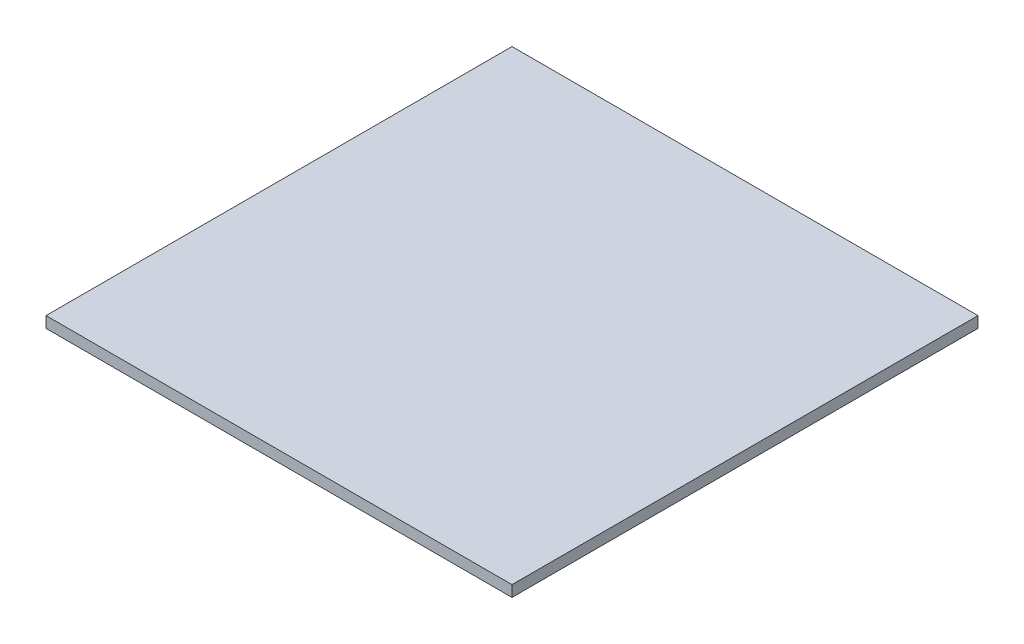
SolidWorks part; units mm, degrees
ref_plane "Front" through (0, 0, 0) normal (0, 0, 1) x (1, 0, 0)
ref_plane "Top" through (0, 0, 0) normal (0, 1, 0) x (1, 0, 0)
ref_plane "Right" through (0, 0, 0) normal (1, 0, 0) x (0, 0, -1)
sketch "Sketch1" plane through (0, 0, 0) normal (0, 1, 0) x (1, 0, 0)
  line L1 (133.35, -133.35) -> (-133.35, -133.35)
  line L2 (133.35, -133.35) -> (133.35, 133.35)
  line L3 (133.35, 133.35) -> (-133.35, 133.35)
  line L4 (-133.35, -133.35) -> (-133.35, 133.35)
  line L5 (133.35, -133.35) -> (-133.35, 133.35) construction
  line L6 (133.35, 133.35) -> (-133.35, -133.35) construction
  point P0 (0, 0)
  dimension "D1" = 266.7
  dimension "D2" = 266.7
extrude "Boss-Extrude1" add sketch "Sketch1" along normal blind 6.35
